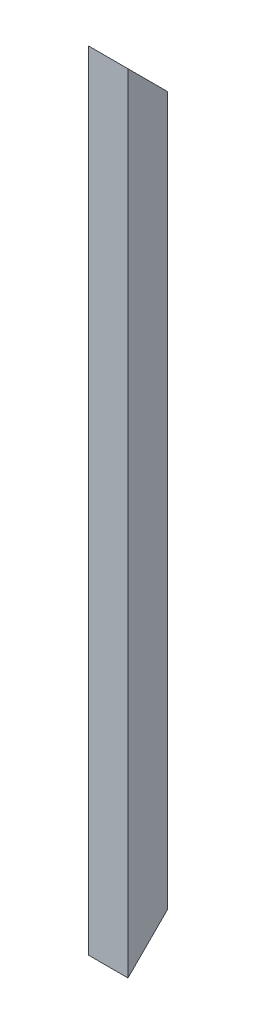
SolidWorks part; units mm, degrees
ref_plane "Front Plane" through (0, 0, 0) normal (0, 0, 1) x (1, 0, 0)
ref_plane "Top Plane" through (0, 0, 0) normal (0, 1, 0) x (1, 0, 0)
ref_plane "Right Plane" through (0, 0, 0) normal (1, 0, 0) x (0, 0, -1)
sketch "Sketch1" plane through (0, 0, 0) normal (0, 1, 0) x (1, 0, 0)
  line L1 (-9.525, -9.525) -> (9.525, -9.525)
  line L2 (-9.525, -9.525) -> (-9.525, 9.525)
  line L3 (-9.525, 9.525) -> (9.525, 9.525)
  line L4 (9.525, -9.525) -> (9.525, 9.525)
  line L5 (-9.525, -9.525) -> (9.525, 9.525) construction
  line L6 (-9.525, 9.525) -> (9.525, -9.525) construction
  line L7 (-12.7, -12.7) -> (12.7, -12.7)
  line L8 (-12.7, -12.7) -> (-12.7, 12.7)
  line L9 (-12.7, 12.7) -> (12.7, 12.7)
  line L10 (12.7, -12.7) -> (12.7, 12.7)
  line L11 (-12.7, -12.7) -> (12.7, 12.7) construction
  line L12 (-12.7, 12.7) -> (12.7, -12.7) construction
  point P0 (0, 0)
  point P6 (0, 0)
  dimension "D1" = 25.4
  dimension "D2" = 25.4
  dimension "D3" = 3.175
  dimension "D4" = 3.175
extrude "Boss-Extrude1" add sketch "Sketch1" along normal blind 508
sketch "Sketch2" plane through (-12.7, 0, 0) normal (-1, 0, 0) x (0, 0, 1)
  line L0 (12.7, 508) -> (-12.7, 482.6)
  line L1 (-12.7, 508) -> (-12.7, 0) construction
  line L2 (-12.7, 482.6) -> (-12.7, 25.4)
  line L3 (-12.7, 25.4) -> (12.7, 0)
  line L4 (12.7, 0) -> (12.7, 508)
  dimension "D1" = 45
  dimension "D2" = 45
extrude "Cut-Extrude1" cut sketch "Sketch2" against normal through all flip side to cut
